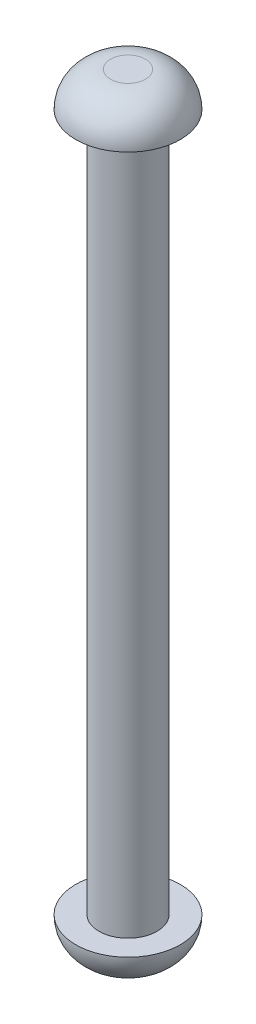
SolidWorks part; units mm, degrees
ref_plane "Front Plane" through (0, 0, 0) normal (0, 0, 1) x (1, 0, 0)
ref_plane "Top Plane" through (0, 0, 0) normal (0, 1, 0) x (1, 0, 0)
ref_plane "Right Plane" through (0, 0, 0) normal (1, 0, 0) x (0, 0, -1)
sketch "Sketch1" plane through (0, 0, 0) normal (0, 1, 0) x (1, 0, 0)
  circle A0 centre (0, 0) radius 2.5
  dimension "D1" = 5
extrude "Boss-Extrude1" add sketch "Sketch1" along normal blind 60
sketch "Sketch2" plane through (0, 60, 0) normal (0, 1, 0) x (1, 0, 0)
  circle A0 centre (0, 0) radius 4.5
  dimension "D1" = 9
extrude "Boss-Extrude2" add sketch "Sketch2" along normal blind 3
fillet "Fillet1" radius 3 1 edges at (0, 63, 4.5)
sketch "Sketch3" plane through (0, 0, 0) normal (0, -1, 0) x (1, 0, 0)
  circle A0 centre (0, 0) radius 4.5
  dimension "D1" = 9
extrude "Boss-Extrude3" add sketch "Sketch3" along normal blind 3
fillet "Fillet2" radius 3 1 edges at (0, -3, -4.5)
